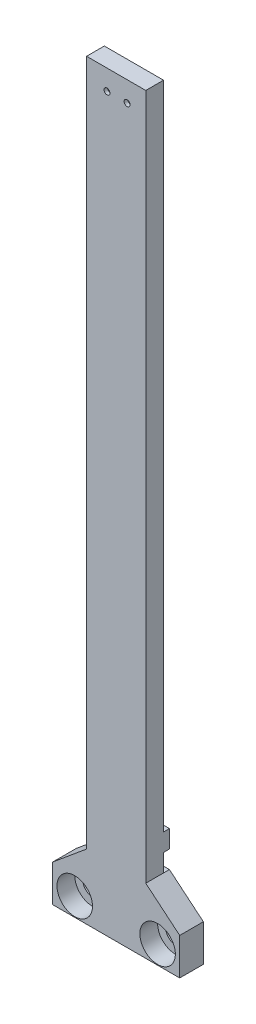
SolidWorks part; units mm, degrees
ref_plane "Front Plane" through (0, 0, 0) normal (0, 0, 1) x (1, 0, 0)
ref_plane "Top Plane" through (0, 0, 0) normal (0, 1, 0) x (1, 0, 0)
ref_plane "Right Plane" through (0, 0, 0) normal (1, 0, 0) x (0, 0, -1)
sketch "Croquis1" plane through (0, 0, 0) normal (0, 0, 1) x (1, 0, 0)
  line L1 (-5, 9.6793) -> (5, 9.6793)
  line L2 (-5, 9.6793) -> (-5, -115.3207)
  line L3 (-5, -115.3207) -> (5, -115.3207)
  line L4 (5, 9.6793) -> (5, -115.3207)
  dimension "D1" = 10
  dimension "D2" = 5
  dimension "D3" = 125
extrude "Saliente-Extruir1" add sketch "Croquis1" along normal blind 3
sketch "Croquis2" plane through (0, 0, 0) normal (0, 0, -1) x (-1, 0, 0)
  line L0 (-5, -115.3207) -> (-5, 9.6793) construction
  line L1 (-5, -106.3207) -> (5, -106.3207)
  line L2 (-5, -106.3207) -> (-5, -115.3207)
  line L3 (-5, -115.3207) -> (5, -115.3207)
  line L4 (5, -106.3207) -> (5, -115.3207)
  line L5 (5, 9.6793) -> (5, -115.3207) construction
  line L6 (-5, -100.3207) -> (5, -100.3207)
  line L7 (-5, -100.3207) -> (-5, -103.3207)
  line L8 (-5, -103.3207) -> (5, -103.3207)
  line L9 (5, -100.3207) -> (5, -103.3207)
  dimension "D1" = 9
  dimension "D2" = 15
  dimension "D3" = 3
extrude "Saliente-Extruir2" add sketch "Croquis2" along normal blind 1
sketch "Croquis3" plane through (0, 0, 0) normal (0, 0, -1) x (-1, 0, 0)
  line L0 (-1.3295, 8.5998) -> (1.3295, 8.5998)
  line L1 (-1.3295, 3.8998) -> (1.3295, 3.8998)
  arc A0 (-1.3295, 8.5998) -> (-1.3295, 3.8998) centre (0, 6.2498) ccw
  arc A1 (1.3295, 3.8998) -> (1.3295, 8.5998) centre (0, 6.2498) ccw
  dimension "D1" = 5.4
  dimension "D2" = 4.7
  dimension "D3" = 2.35
  dimension "D4" = 6.2498
extrude "Cortar-Extruir1" cut sketch "Croquis3" against normal blind 2.4
sketch "Croquis4" plane through (0, 0, 2.4) normal (0, 0, -1) x (-1, 0, 0)
  line L0 (0, 0) -> (0, 9.5847) construction
  line L1 (-2.7, 6.2498) -> (2.7, 6.2498) construction
  arc A0 (-1.3295, 8.5998) -> (-1.3295, 3.8998) centre (0, 6.2498) ccw construction
  arc A1 (1.3295, 3.8998) -> (1.3295, 8.5998) centre (0, 6.2498) ccw construction
  circle A2 centre (-1.85, 6.2498) radius 0.5
  circle A3 centre (1.55, 6.2498) radius 0.5
  dimension "D1" = 1
  dimension "D2" = 1
  dimension "D3" = 3.4
  dimension "D4" = 0.85
  dimension "D5" = 1.15
extrude "Cortar-Extruir2" cut sketch "Croquis4" against normal blind 4
sketch "Croquis6" plane through (0, 0, 3) normal (0, 0, 1) x (1, 0, 0)
  line L0 (5, -106.3207) -> (10.7337, -111.0885)
  line L1 (10.7337, -111.0885) -> (10.7337, -117.0885)
  line L2 (26.7269, -117.0885) -> (-23.2731, -117.0885) construction
  line L3 (10.7337, -117.0885) -> (5, -117.0885)
  line L4 (5, -117.0885) -> (5, -106.3207)
  line L5 (0, -115.3207) -> (0, -97.4142) construction
  line L6 (-5, -115.3207) -> (5, -115.3207) construction
  line L7 (-5, -117.0885) -> (-5, -106.3207)
  line L8 (-10.7337, -117.0885) -> (-5, -117.0885)
  line L9 (-10.7337, -111.0885) -> (-10.7337, -117.0885)
  line L10 (-5, -106.3207) -> (-10.7337, -111.0885)
  dimension "D1" = 6
extrude "Saliente-Extruir3" add sketch "Croquis6" against normal blind 4
sketch "Croquis9" plane through (0, 0, 3) normal (0, 0, 1) x (1, 0, 0)
  line L0 (-10.7337, -111.0885) -> (-10.7337, -117.0885) construction
  line L1 (-10.7337, -115.3207) -> (10.7337, -115.3207)
  line L2 (-10.7337, -115.3207) -> (-10.7337, -117.3207)
  line L3 (-10.7337, -117.3207) -> (10.7337, -117.3207)
  line L4 (10.7337, -115.3207) -> (10.7337, -117.3207)
  line L5 (10.7337, -117.0885) -> (10.7337, -111.0885) construction
  dimension "D1" = 2
extrude "Saliente-Extruir4" add sketch "Croquis9" against normal blind 4
sketch "Croquis7" plane through (0, 0, 3) normal (0, 0, 1) x (1, 0, 0)
  line L0 (10.7337, -114.2046) -> (-10.7337, -114.2046) construction
  line L1 (10.7337, -117.3207) -> (10.7337, -111.0885) construction
  line L2 (-10.7337, -111.0885) -> (-10.7337, -117.3207) construction
  line L3 (0, -114.2046) -> (0, -99.8981) construction
  line L4 (-10.7337, -117.3207) -> (10.7337, -117.3207) construction
  circle A0 centre (7, -114.2046) radius 3
  circle A1 centre (-7, -114.2046) radius 3
  dimension "D1" = 6
  dimension "D2" = 6
  dimension "D3" = 14
  dimension "D4" = 7
  dimension "D5" = 3.1161
extrude "Cortar-Extruir4" cut sketch "Croquis7" against normal blind 3
sketch "Croquis8" plane through (0, 0, 0) normal (0, 0, 1) x (1, 0, 0)
  circle A0 centre (7, -114.2046) radius 1.625
  circle A1 centre (-7, -114.2046) radius 1.625
  dimension "D1" = 3.25
  dimension "D2" = 3.25
extrude "Cortar-Extruir5" cut sketch "Croquis8" against normal blind 6
